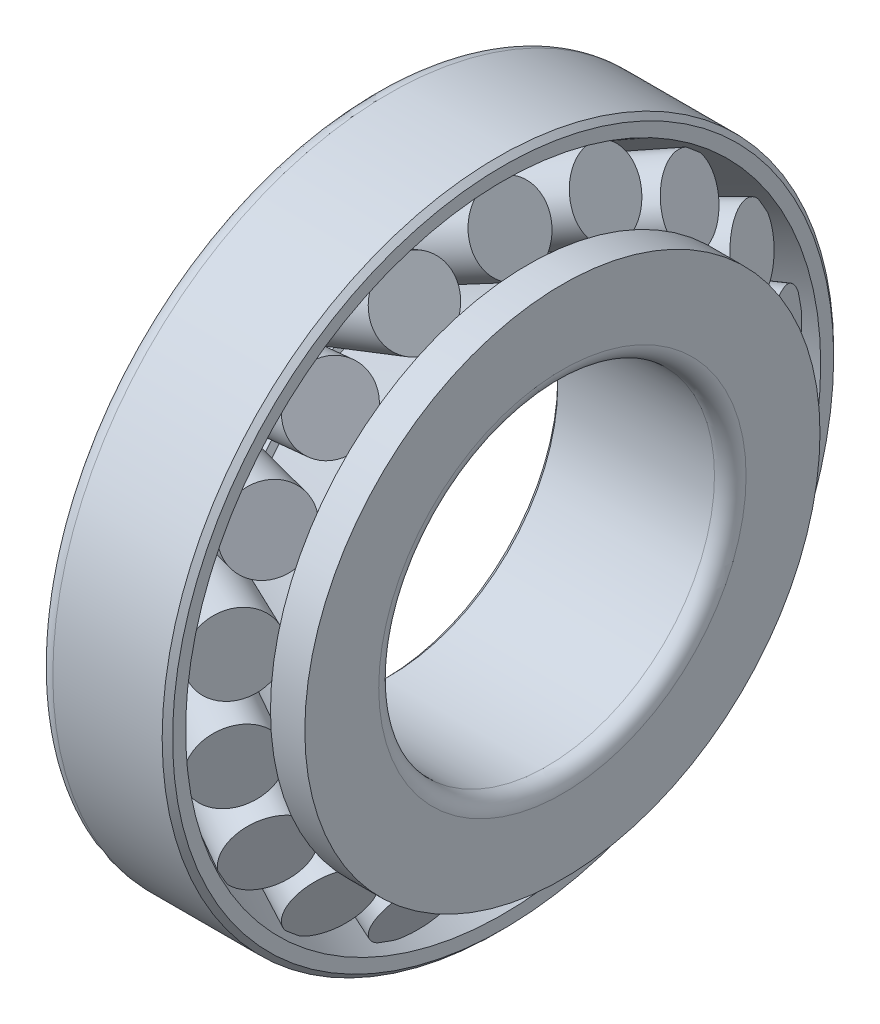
SolidWorks part; units mm, degrees
ref_plane "Plane1" through (0, 0, 0) normal (0, 0, 1) x (1, 0, 0)
ref_plane "Plane2" through (0, 0, 0) normal (0, 1, 0) x (1, 0, 0)
ref_plane "Plane3" through (0, 0, 0) normal (1, 0, 0) x (0, 0, -1)
sketch "Clipboard" plane through (0, 0, 0) normal (0, 0, 1) x (1, 0, 0)
  line L0 (0, 0) -> (10, 0) construction
  line L1 (0, 0) -> (119.4793, -38.8212)
  line L2 (0, 0) -> (73.6122, 42.5)
  line L3 (0, 0) -> (147.2243, -85)
  line L4 (0, 0) -> (-29.6819, -1.0365)
  line L5 (0, 0) -> (-19.25, 48)
  dimension "Bore" = 85
  dimension "Count" = 30
  dimension "Show_count" = 30
  dimension "Max_count" = 18
  dimension "Min_count" = 2
  dimension "Race_OD" = 170
  dimension "Race_ID" = 125.628
  dimension "cyl_len" = 29.7
  dimension "Roller_diameter" = 19.25
  dimension "OA_width" = 48
sketch "OutRacSke" plane through (0, 0, 0) normal (0, 0, 1) x (1, 0, 0)
  line L0 (-15, 80.39) -> (-48, 62.814)
  line L1 (-48, 62.814) -> (-48, 81)
  line L2 (-44, 85) -> (-16.32, 85)
  line L3 (-16.32, 85) -> (-15, 83.68)
  line L4 (-15, 83.68) -> (-15, 80.39)
  line L5 (-42.5, 0) -> (42.5, 0) construction
  arc A0 (-48, 81) -> (-44, 85) centre (-44, 81) cw
  dimension "cup_radius" = 4
  dimension "OD" = 170
  dimension "cup_width" = 33
  dimension "Tangle" = 28.04
  dimension "offset" = 48
  dimension "chamfer" = 1.32
  dimension "D8" = 45
  dimension "cup_SID" = 125.628
revolve "OuterRace" add sketch "OutRacSke" angle 360 about L5
sketch "RolDetSke" plane through (0, 0, 0) normal (0, 0, 1) x (1, 0, 0)
  line L0 (-39.4754, 56.7739) -> (-44, 65.2691)
  line L1 (-39.4754, 56.7739) -> (-13.2616, 70.7355)
  line L2 (-17.7862, 79.2308) -> (-13.2616, 70.7355)
  line L4 (-49.0629, 51.6676) -> (-2.2918, 76.5781) construction
  line L5 (-17.7862, 79.2308) -> (-44, 65.2691)
  line L9 (-15, 80.39) -> (-48, 62.814) construction
  dimension "cyl_len" = 29.7
  dimension "D2" = 44
  dimension "Roller_diameter" = 19.25
  dimension "dy" = 65.2691
revolve "RollerDetailed" add sketch "RolDetSke" angle 360 about L4
sketch "RolSimSke" plane through (0, 0, 0) normal (0, 0, 1) x (1, 0, 0)
  line L0 (0, 0) -> (-32, 0) construction
  line L1 (-44, 65.2691) -> (-17.7862, 79.2308)
  line L2 (-44, 65.2691) -> (-34.9508, 48.2787)
  line L3 (-34.9508, 48.2787) -> (-8.737, 62.2403)
  line L4 (-17.7862, 79.2308) -> (-8.737, 62.2403)
  dimension "Roller_diameter" = 19.25
  dimension "Cyl_Len" = 29.7
  dimension "dx" = 44
  dimension "dy" = 65.2691
  dimension "Tangle" = 28.04
revolve "RollersSimplified" [suppressed] add sketch "RolSimSke" angle 360 about L0
ref_axis "Axis1" through (-50, 0, 0) along (1, 0, 0)
pattern_circular "RollersDetailed" count 18 every 20 about axis through (-50, 0, 0) along (1, 0, 0) of "RollerDetailed", "OuterRace"
sketch "InsRacSke" plane through (0, 0, 0) normal (0, 0, 1) x (1, 0, 0)
  line L0 (-35.6965, 49.7637) -> (-45, 49.7637)
  line L1 (-48, 81) -> (-48, -81) construction
  line L2 (-45, 49.7637) -> (-45, 43.82)
  line L3 (-45, 43.82) -> (-43.68, 42.5)
  line L4 (-43.68, 42.5) -> (-4, 42.5)
  line L5 (0, 46.5) -> (0, 65.2103)
  line L6 (0, 65.2103) -> (-8.6918, 65.2103)
  line L7 (-8.6918, 65.2103) -> (-8.6918, 62.2403)
  line L8 (-8.6918, 62.2403) -> (-34.9056, 48.2787)
  line L9 (-34.9056, 48.2787) -> (-35.6965, 49.7637)
  line L10 (-42.5, 0) -> (42.5, 0) construction
  arc A0 (-4, 42.5) -> (0, 46.5) centre (-4, 46.5) ccw
  dimension "cone_radius" = 4
  dimension "Bore" = 85
  dimension "D2" = 48
  dimension "cone_width" = 45
  dimension "Tangle" = 28.04
  dimension "cyl_len" = 29.7
  dimension "dy" = 48.2787
  dimension "dx" = 34.9056
  dimension "chamfer" = 1.32
  dimension "D11" = 45
  dimension "front_groove" = 1.485
  dimension "Groove_dp" = 2.97
revolve "InnerRace" add sketch "InsRacSke" angle 360 about L10
sketch "CagSpiSke" plane through (0, 0, 0) normal (0, 0, 1) x (1, 0, 0)
  line L3 (-11.9509, 71.1089) -> (-39.4754, 56.4492)
  line L4 (-40.0048, 54.7132) -> (-38.7983, 52.4478)
  line L6 (-42.5, 0) -> (42.5, 0) construction
  arc A1 (-39.4754, 56.4492) -> (-40.0048, 54.7132) centre (-38.8721, 55.3165) ccw
  dimension "radius" = 1.2833
  dimension "Tangle" = 28.04
  dimension "offset" = 3.85
  dimension "dx" = 39.4754
  dimension "dy" = 56.4492
  dimension "length" = 31.185
revolve "CageSpine" [suppressed] add sketch "CagSpiSke" angle 360 about L6
equation "\"OD@OutRacSke\" = \"Race_OD@Clipboard\""
equation "\"cup_SID@OutRacSke\" = \"Race_ID@Clipboard\""
equation "\"chamfer@OutRacSke\" = \"cup_width@OutRacSke\" / 25"
equation "\"offset@OutRacSke\" = \"OA_width@Clipboard\""
equation "\"D2@RolDetSke\" = \"offset@OutRacSke\" - \"cup_radius@OutRacSke\""
equation "\"dy@RolDetSke\" =  ( ( \"Race_ID@Clipboard\" / 2 ) + ( \"cup_radius@OutRacSke\" ) * tan(\"Tangle@OutRacSke\" * 3.141592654/180) ) * 1.005"
equation "\"cyl_len@RolDetSke\" = \"cyl_len@Clipboard\""
equation "\"Roller_diameter@RolDetSke\" = \"Roller_diameter@Clipboard\""
equation "\"Dx@RolSimSke\" = \"offset@OutRacSke\" - \"cup_radius@OutRacSke\""
equation "\"dy@RolSimSke\" =  ( ( \"Race_ID@Clipboard\" / 2 ) + ( \"cup_radius@OutRacSke\" ) * tan(\"Tangle@OutRacSke\" * 3.141592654/180) ) * 1.005"
equation "\"cyl_len@RolSimSke\" = \"cyl_len@Clipboard\""
equation "\"Roller_diameter@RolSimSke\" = \"Roller_diameter@Clipboard\""
equation "\"Bore@InsRacSke\" = \"Bore@Clipboard\""
equation "\"Tangle@InsRacSke\" = \"Tangle@OutRacSke\""
equation "\"cyl_len@InsRacSke\" = \"cyl_len@Clipboard\""
equation "\"chamfer@InsRacSke\" = \"chamfer@OutRacSke\""
equation "\"d2@InsRacSke\" = \"OA_width@Clipboard\""
equation "\"dx@InsRacSke\" = \"offset@OutRacSke\" - \"cup_radius@OutRacSke\" -  (  \"Roller_diameter@Clipboard\" * 1.005 )  * sin(\"Tangle@InsRacSke\" * 3.141592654/180)"
equation "\"dy@InsRacSke\" = ( ( \"Race_ID@Clipboard\" / 2 ) + ( \"cup_radius@OutRacSke\" ) * tan(\"Tangle@OutRacSke\" * 3.141592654/180) ) * 1.005 -  ( \"Roller_diameter@Clipboard\" )  * cos(\"Tangle@InsRacSke\" * 3.14159"
equation "\"front_groove@InsRacSke\" = \"Groove_dp@InsRacSke\" / 2"
equation "\"Tangle@CagSpiSke\" = \"Tangle@OutRacSke\""
equation "\"dx@CagSpiSke\" = ( \"offset@OutRacSke\" - \"cup_radius@OutRacSke\" ) -  (  \"Roller_diameter@Clipboard\" / 2  )  * sin(\"Tangle@InsRacSke\" * 3.141592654/180)"
equation "\"dy@CagSpiSke\" = ( ( \"Race_ID@Clipboard\" / 2 ) + ( \"cup_radius@OutRacSke\" ) * tan(\"Tangle@OutRacSke\" * 3.141592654/180) )  -  ( \"Roller_diameter@Clipboard\" / 2 )  * cos(\"Tangle@InsRacSke\" * 3.14159265"
equation "\"length@CagSpiSke\" = \"cyl_len@Clipboard\" * 1.05"
equation "\"offset@CagSpiSke\" = \"Roller_diameter@Clipboard\" / 5"
equation "\"radius@CagSpiSke\" = \"offset@CagSpiSke\" / 3"
equation "\"D3@CageSpine\" = \"Roller_diameter@Clipboard\" / 6"
equation "\"Max_count@Clipboard\" = int( 3.14159265 / atn(( \"Roller_diameter@Clipboard\" / 2) / sqr( \"dy@CagSpiSke\"  *  \"dy@CagSpiSke\" - ( \"Roller_diameter@Clipboard\" / 2) *  ( \"Roller_diameter@Clipboard\" / 2))))"
equation "\"Max_count@Clipboard\" = ((sgn( \"Max_count@Clipboard\" - \"Count@Clipboard\" )-1)*( \"Max_count@Clipboard\" - \"Count@Clipboard\" ))/-2+ \"Count@Clipboard\""
equation "\"Count@RollersDetailed\" = int( \"Show_count@Clipboard\" ) "
equation "\"Count@RollersDetailed\" = ((sgn( \"Count@RollersDetailed\" - \"Max_count@Clipboard\" )-1)*( \"Count@RollersDetailed\" - \"Max_count@Clipboard\" ))/-2+ \"Max_count@Clipboard\""
equation "\"Count@RollersDetailed\" = ((sgn( \"Count@RollersDetailed\" - \"Min_count@Clipboard\" )+1)*( \"Count@RollersDetailed\" - \"Min_count@Clipboard\"))/2 +\"Min_count@Clipboard\""
equation "\"Angle@RollersDetailed\" = 360.0 / \"Max_count@Clipboard\""
equation "\"Angle@CageSpine\" =  \"Angle@RollersDetailed\" * ( \"Count@RollersDetailed\" -1 + int( \"Count@RollersDetailed\" / \"Max_count@Clipboard\" ) )  + 0.001 -  int( \"Count@RollersDetailed\" / \"Max_count@Clipboard\" "
equation "\"Angle@CageSpine\" =  \"Angle@CageSpine\" * int( \"Min_count@Clipboard\" / 2) + int(1 / \"Min_count@Clipboard\")  * 0.001"
equation "\"Tangle@RolSimSke\" = \"Tangle@OutRacSke\""
